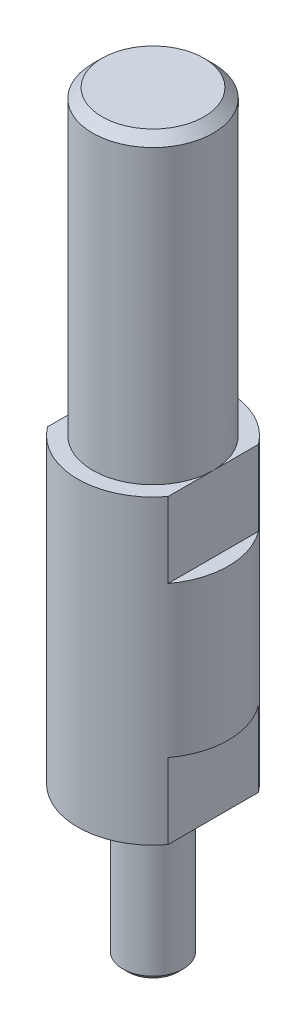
SolidWorks part; units mm, degrees
ref_plane "Front Plane" through (0, 0, 0) normal (0, 0, 1) x (1, 0, 0)
ref_plane "Top Plane" through (0, 0, 0) normal (0, 1, 0) x (1, 0, 0)
ref_plane "Right Plane" through (0, 0, 0) normal (1, 0, 0) x (0, 0, -1)
sketch "Sketch1" plane through (0, 0, 0) normal (0, 0, 1) x (1, 0, 0)
  line L0 (0, 0) -> (0, 20)
  line L1 (0, 20) -> (4, 20)
  line L2 (4, 20) -> (4, 0)
  line L3 (4, 0) -> (5, 0)
  line L4 (5, 0) -> (5, -20)
  line L5 (5, -20) -> (2, -20)
  line L6 (2, -20) -> (2, -30)
  line L7 (2, -30) -> (0, -30)
  line L8 (0, -30) -> (0, 0)
  point P3 (0, -15)
  dimension "D1" = 4
  dimension "D2" = 20
  dimension "D3" = 20
  dimension "D4" = 5
  dimension "D5" = 2
  dimension "D6" = 10
revolve "Revolve1" add sketch "Sketch1" angle 360 about L8
sketch "Sketch2" plane through (0, -20, 0) normal (0, -1, 0) x (1, 0, 0)
  line L1 (-4, 5.3504) -> (4, 5.3504)
  line L2 (-4, 5.3504) -> (-4, -5.3504)
  line L3 (-4, -5.3504) -> (4, -5.3504)
  line L4 (4, 5.3504) -> (4, -5.3504)
  line L5 (-4, 5.3504) -> (4, -5.3504) construction
  line L6 (-4, -5.3504) -> (4, 5.3504) construction
  point P0 (0, 0)
  dimension "D1" = 8
extrude "Cut-Extrude1" cut sketch "Sketch2" against normal blind 5 flip side to cut
sketch "Sketch3" plane through (0, 0, 0) normal (0, 1, 0) x (1, 0, 0)
  line L1 (-4, 5.497) -> (4, 5.497)
  line L2 (-4, 5.497) -> (-4, -5.497)
  line L3 (-4, -5.497) -> (4, -5.497)
  line L4 (4, 5.497) -> (4, -5.497)
  line L5 (-4, 5.497) -> (4, -5.497) construction
  line L6 (-4, -5.497) -> (4, 5.497) construction
  point P0 (0, 0)
  dimension "D1" = 8
extrude "Cut-Extrude2" cut sketch "Sketch3" against normal blind 5 flip side to cut
chamfer "Chamfer2" distance 0.35 angle 45 1 edges at (2, -30, 0)
chamfer "Chamfer3" distance 0.625 angle 45 1 edges at (4, 20, 0)
